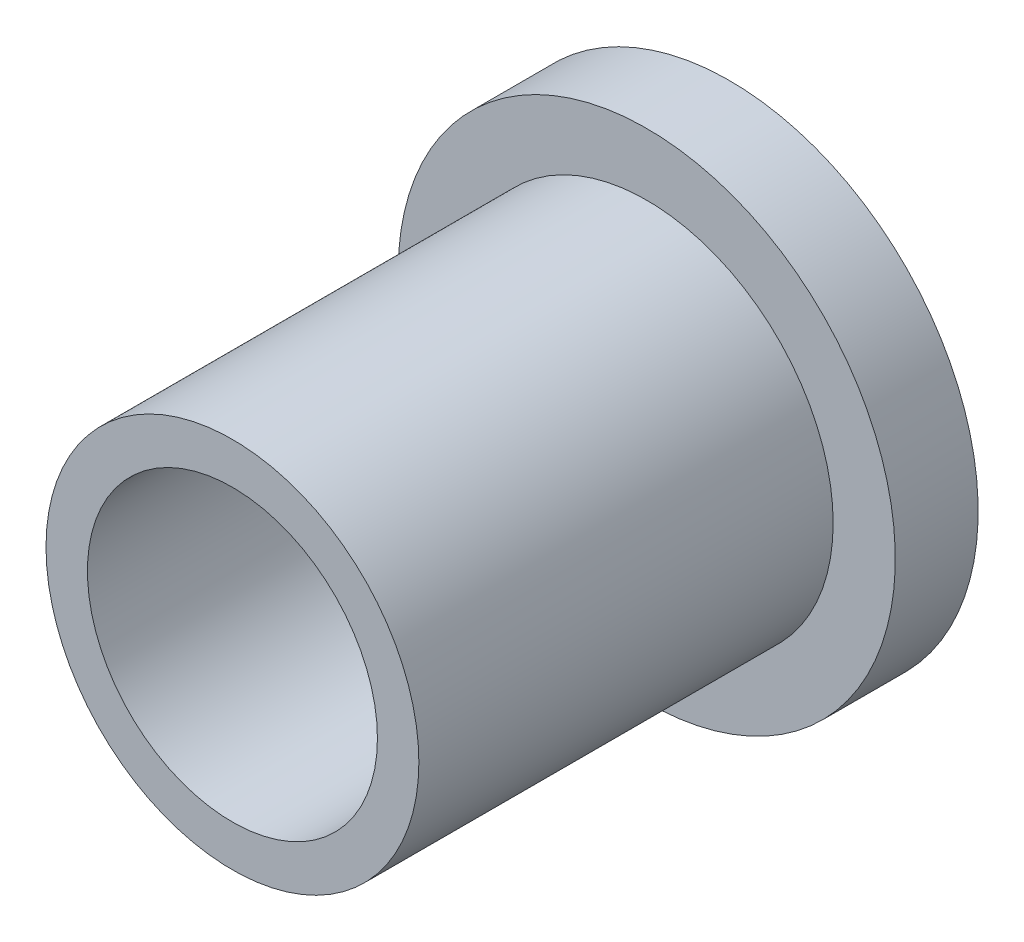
SolidWorks part; units mm, degrees
ref_plane "Plan de face" through (0, 0, 0) normal (0, 0, 1) x (1, 0, 0)
ref_plane "Plan de dessus" through (0, 0, 0) normal (0, 1, 0) x (1, 0, 0)
ref_plane "Plan de droite" through (0, 0, 0) normal (1, 0, 0) x (0, 0, -1)
sketch "Esquisse1" plane through (0, 0, 0) normal (0, 0, 1) x (1, 0, 0)
  circle A0 centre (0, 0) radius 2.25
  circle A1 centre (0, 0) radius 1.75
  dimension "D1" = 3.5
  dimension "D2" = 4.5
extrude "Extrusion1" add sketch "Esquisse1" along normal blind 6
sketch "Esquisse2" plane through (0, 0, 0) normal (0, 0, -1) x (-1, 0, 0)
  circle A0 centre (0, 0) radius 3
  circle A1 centre (0, 0) radius 1.75 construction
  circle A2 centre (0, 0) radius 1.75
  dimension "D1" = 6
extrude "Extrusion2" add sketch "Esquisse2" against normal blind 1
